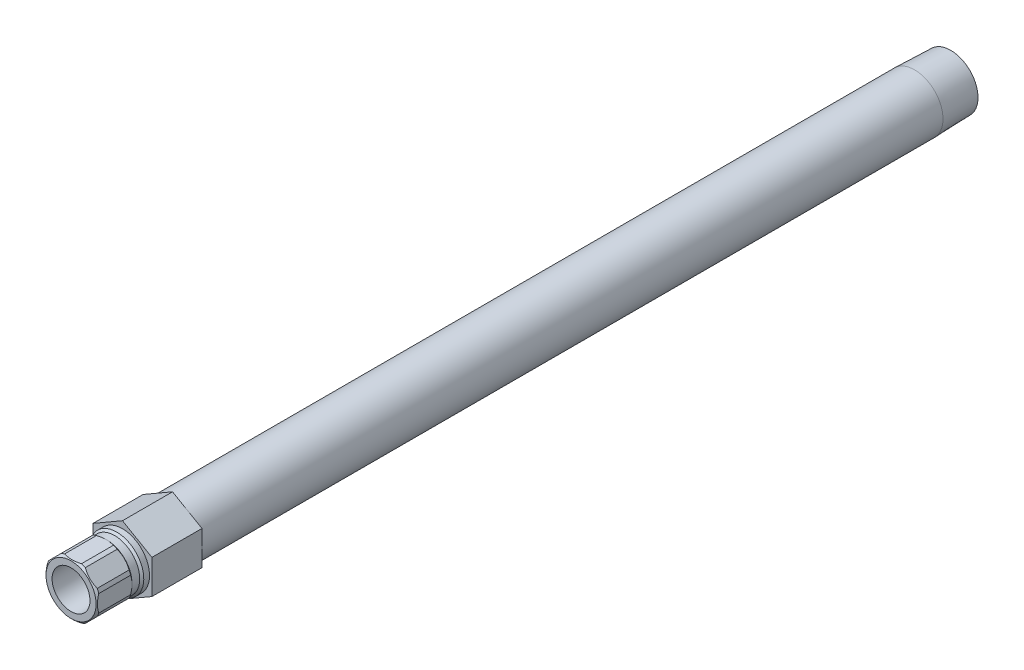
SolidWorks part; units mm, degrees
ref_plane "Front Plane" through (0, 0, 0) normal (0, 0, 1) x (1, 0, 0)
ref_plane "Top Plane" through (0, 0, 0) normal (0, 1, 0) x (1, 0, 0)
ref_plane "Right Plane" through (0, 0, 0) normal (1, 0, 0) x (0, 0, -1)
sketch "Sketch1" plane through (0, 0, 0) normal (1, 0, 0) x (0, 0, -1)
  line L0 (0, 0) -> (-22.479, 0) construction
  line L1 (-19.304, 7.112) -> (-19.304, 9.398)
  line L2 (-5.8166, 9.398) -> (-5.8166, 0) construction
  line L3 (-18.542, 10.16) -> (-6.5786, 10.16)
  line L4 (0, 10.668) -> (0, 0) construction
  line L5 (-5.8166, 9.398) -> (-2.921, 9.398)
  line L6 (-2.159, 10.16) -> (0, 10.16)
  line L7 (0, 10.16) -> (0, 10.668)
  line L8 (-5.8166, 9.398) -> (-6.5786, 10.16)
  line L9 (-2.921, 9.398) -> (-2.159, 10.16)
  line L10 (-19.304, 9.398) -> (-18.542, 10.16)
  line L11 (-19.304, 7.112) -> (-1.524, 7.112)
  line L12 (0, 10.668) -> (297.3324, 10.668)
  line L13 (297.3324, 10.668) -> (310.896, 10.2441)
  line L14 (310.896, 10.2441) -> (310.896, 7.8994)
  line L15 (0, 10.16) -> (18.796, 10.16) construction
  line L16 (18.796, 10.16) -> (18.796, 0) construction
  line L17 (18.796, 0) -> (0, 0) construction
  line L18 (-1.524, 7.112) -> (-1.1053, 7.8994)
  line L19 (-1.1053, 7.8994) -> (310.896, 7.8994)
  dimension "D1" = 19.304
  dimension "D2" = 2.8956
  dimension "D3" = 0.762
  dimension "D4" = 45
  dimension "D5" = 13.4874
  dimension "D6" = 45
  dimension "D7" = 1.79
  dimension "D8" = 13.5636
  dimension "D9" = 330.2
  dimension "D10" = 3.175
  dimension "D11" = 38.1
  dimension "D12" = 14.224
  dimension "D13" = 21.336
  dimension "D14" = 20.32
  dimension "D15" = 15.7988
  dimension "D16" = 118
  dimension "D17" = 17.78
revolve "Revolve1" add sketch "Sketch1" angle 360 about L0
sketch "Sketch2" plane through (0, 0, 0) normal (0, 0, 1) x (1, 0, 0)
  line L1 (-11.049, 6.3791) -> (-11.049, -6.3791)
  line L2 (-11.049, -6.3791) -> (0, -12.7583)
  line L3 (0, -12.7583) -> (11.049, -6.3791)
  line L4 (11.049, -6.3791) -> (11.049, 6.3791)
  line L5 (11.049, 6.3791) -> (0, 12.7583)
  line L6 (0, 12.7583) -> (-11.049, 6.3791)
  circle A0 centre (0, 0) radius 11.049 construction
  circle A1 centre (0, 0) radius 7.112 construction
  circle A2 centre (0, 0) radius 7.112
  dimension "D1" = 22.098
extrude "Boss-Extrude1" add sketch "Sketch2" against normal up to vertex (18.796 mm away) from vertex at 0
sketch "Sketch3" plane through (0, 0, 0) normal (0, 0, 1) x (1, 0, 0)
  line L1 (9.652, -3.998) -> (9.652, 3.998)
  line L2 (9.652, 3.998) -> (3.998, 9.652)
  line L3 (3.998, 9.652) -> (-3.998, 9.652)
  line L4 (-3.998, 9.652) -> (-9.652, 3.998)
  line L5 (-9.652, 3.998) -> (-9.652, -3.998)
  line L6 (-9.652, -3.998) -> (-3.998, -9.652)
  line L7 (-3.998, -9.652) -> (3.998, -9.652)
  line L8 (3.998, -9.652) -> (9.652, -3.998)
  circle A0 centre (0, 0) radius 9.652 construction
  dimension "D1" = 19.304
extrude "Cut-Extrude1" cut sketch "Sketch3" along normal through all from vertex at 5.8166 flip side to cut
